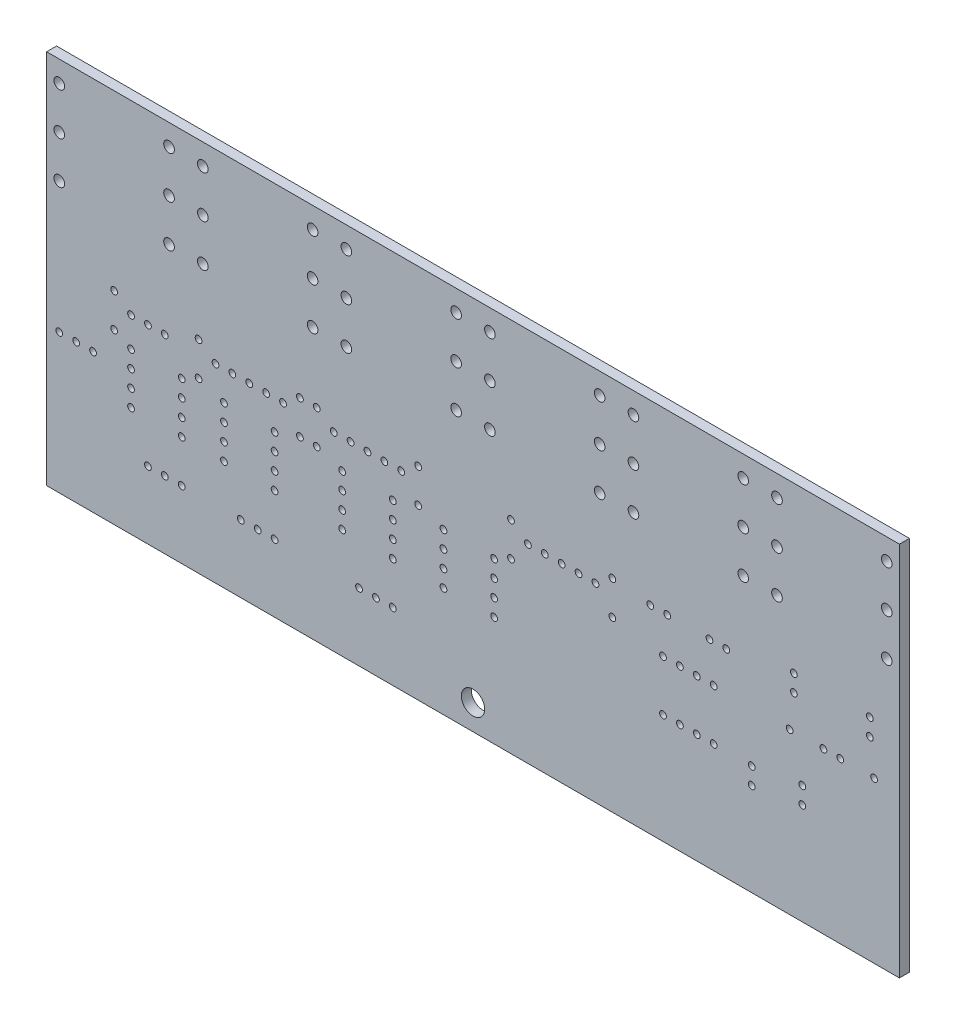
SolidWorks part; units mm, degrees
ref_plane "Front Plane" through (0, 0, 0) normal (0, 0, 1) x (1, 0, 0)
ref_plane "Top Plane" through (0, 0, 0) normal (0, 1, 0) x (1, 0, 0)
ref_plane "Right Plane" through (0, 0, 0) normal (1, 0, 0) x (0, 0, -1)
sketch "Sketch1" plane through (0, 0, 0) normal (0, 0, 1) x (1, 0, 0)
  line L1 (0, 0) -> (128.27, 0)
  line L2 (0, 0) -> (0, -56.515)
  line L3 (0, -56.515) -> (128.27, -56.515)
  line L4 (128.27, 0) -> (128.27, -56.515)
  circle A0 centre (88.265, -3.175) radius 0.8001
  circle A1 centre (82.55, -27.94) radius 0.508
  circle A2 centre (1.905, -35.56) radius 0.508
  circle A3 centre (6.985, -35.56) radius 0.508
  circle A4 centre (113.665, -41.275) radius 0.508
  circle A5 centre (12.7, -27.94) radius 0.508
  circle A6 centre (17.78, -27.94) radius 0.508
  circle A7 centre (15.24, -27.94) radius 0.508
  circle A8 centre (1.905, -3.175) radius 0.8001
  circle A9 centre (1.905, -9.525) radius 0.8001
  circle A10 centre (1.905, -15.875) radius 0.8001
  circle A11 centre (18.415, -3.175) radius 0.8001
  circle A12 centre (18.415, -15.875) radius 0.8001
  circle A13 centre (23.495, -3.175) radius 0.8001
  circle A14 centre (18.415, -9.525) radius 0.8001
  circle A15 centre (23.495, -9.525) radius 0.8001
  circle A16 centre (23.495, -15.875) radius 0.8001
  circle A17 centre (40.005, -3.175) radius 0.8001
  circle A18 centre (40.005, -9.525) radius 0.8001
  circle A19 centre (40.005, -15.875) radius 0.8001
  circle A20 centre (25.4, -27.94) radius 0.508
  circle A21 centre (15.24, -46.355) radius 0.508
  circle A22 centre (88.265, -9.525) radius 0.8001
  circle A23 centre (33.02, -27.94) radius 0.508
  circle A24 centre (88.265, -15.875) radius 0.8001
  circle A25 centre (27.94, -27.94) radius 0.508
  circle A26 centre (30.48, -27.94) radius 0.508
  circle A27 centre (104.775, -3.175) radius 0.8001
  circle A28 centre (52.07, -46.355) radius 0.508
  circle A29 centre (46.99, -46.355) radius 0.508
  circle A30 centre (104.775, -9.525) radius 0.8001
  circle A31 centre (4.445, -35.56) radius 0.508
  circle A32 centre (17.78, -46.355) radius 0.508
  circle A33 centre (104.775, -15.875) radius 0.8001
  circle A34 centre (109.855, -3.175) radius 0.8001
  circle A35 centre (20.32, -46.355) radius 0.508
  circle A36 centre (43.18, -27.94) radius 0.508
  circle A37 centre (35.56, -27.94) radius 0.508
  circle A38 centre (109.855, -9.525) radius 0.8001
  circle A39 centre (109.855, -15.875) radius 0.8001
  circle A40 centre (49.53, -46.355) radius 0.508
  circle A41 centre (126.365, -3.175) radius 0.8001
  circle A42 centre (31.75, -46.355) radius 0.508
  circle A43 centre (34.29, -46.355) radius 0.508
  circle A44 centre (29.21, -46.355) radius 0.508
  circle A45 centre (126.365, -9.525) radius 0.8001
  circle A46 centre (126.365, -15.875) radius 0.8001
  circle A47 centre (10.16, -26.035) radius 0.508
  circle A48 centre (10.16, -31.115) radius 0.508
  circle A49 centre (113.665, -38.735) radius 0.508
  circle A50 centre (22.86, -26.035) radius 0.508
  circle A51 centre (45.72, -27.94) radius 0.508
  circle A52 centre (48.26, -27.94) radius 0.508
  circle A53 centre (50.8, -27.94) radius 0.508
  circle A54 centre (53.34, -27.94) radius 0.508
  circle A55 centre (72.39, -27.94) radius 0.508
  circle A56 centre (64.135, -52.705) radius 1.7526
  circle A57 centre (74.93, -27.94) radius 0.508
  circle A58 centre (77.47, -27.94) radius 0.508
  circle A59 centre (80.01, -27.94) radius 0.508
  circle A60 centre (22.86, -31.115) radius 0.508
  circle A61 centre (38.1, -26.035) radius 0.508
  circle A62 centre (38.1, -31.115) radius 0.508
  circle A63 centre (45.085, -3.175) radius 0.8001
  circle A64 centre (45.085, -9.525) radius 0.8001
  circle A65 centre (45.085, -15.875) radius 0.8001
  circle A66 centre (61.595, -3.175) radius 0.8001
  circle A67 centre (61.595, -9.525) radius 0.8001
  circle A68 centre (61.595, -15.875) radius 0.8001
  circle A69 centre (66.675, -3.175) radius 0.8001
  circle A70 centre (66.675, -9.525) radius 0.8001
  circle A71 centre (66.675, -15.875) radius 0.8001
  circle A72 centre (83.185, -3.175) radius 0.8001
  circle A73 centre (83.185, -9.525) radius 0.8001
  circle A74 centre (83.185, -15.875) radius 0.8001
  circle A75 centre (40.64, -26.035) radius 0.508
  circle A76 centre (40.64, -31.115) radius 0.508
  circle A77 centre (55.88, -26.035) radius 0.508
  circle A78 centre (55.88, -31.115) radius 0.508
  circle A79 centre (69.85, -26.035) radius 0.508
  circle A80 centre (69.85, -31.115) radius 0.508
  circle A81 centre (85.09, -26.035) radius 0.508
  circle A82 centre (85.09, -31.115) radius 0.508
  circle A83 centre (90.805, -26.67) radius 0.508
  circle A84 centre (93.345, -26.67) radius 0.508
  circle A85 centre (99.695, -26.67) radius 0.508
  circle A86 centre (102.235, -26.67) radius 0.508
  circle A87 centre (106.045, -40.005) radius 0.508
  circle A88 centre (106.045, -42.545) radius 0.508
  circle A89 centre (112.395, -24.765) radius 0.508
  circle A90 centre (112.395, -27.305) radius 0.508
  circle A91 centre (123.825, -24.765) radius 0.508
  circle A92 centre (123.825, -27.305) radius 0.508
  circle A93 centre (111.76, -32.385) radius 0.508
  circle A94 centre (116.84, -32.385) radius 0.508
  circle A95 centre (119.38, -32.385) radius 0.508
  circle A96 centre (124.46, -32.385) radius 0.508
  circle A97 centre (92.71, -32.385) radius 0.508
  circle A98 centre (95.25, -32.385) radius 0.508
  circle A99 centre (97.79, -32.385) radius 0.508
  circle A100 centre (100.33, -32.385) radius 0.508
  circle A101 centre (92.71, -40.005) radius 0.508
  circle A102 centre (95.25, -40.005) radius 0.508
  circle A103 centre (97.79, -40.005) radius 0.508
  circle A104 centre (100.33, -40.005) radius 0.508
  circle A105 centre (67.31, -40.005) radius 0.508
  circle A106 centre (67.31, -37.465) radius 0.508
  circle A107 centre (67.31, -34.925) radius 0.508
  circle A108 centre (67.31, -32.385) radius 0.508
  circle A109 centre (59.69, -40.005) radius 0.508
  circle A110 centre (59.69, -37.465) radius 0.508
  circle A111 centre (59.69, -34.925) radius 0.508
  circle A112 centre (59.69, -32.385) radius 0.508
  circle A113 centre (34.29, -40.005) radius 0.508
  circle A114 centre (34.29, -37.465) radius 0.508
  circle A115 centre (34.29, -34.925) radius 0.508
  circle A116 centre (34.29, -32.385) radius 0.508
  circle A117 centre (26.67, -40.005) radius 0.508
  circle A118 centre (26.67, -37.465) radius 0.508
  circle A119 centre (26.67, -34.925) radius 0.508
  circle A120 centre (26.67, -32.385) radius 0.508
  circle A121 centre (52.07, -40.005) radius 0.508
  circle A122 centre (52.07, -37.465) radius 0.508
  circle A123 centre (52.07, -34.925) radius 0.508
  circle A124 centre (52.07, -32.385) radius 0.508
  circle A125 centre (44.45, -40.005) radius 0.508
  circle A126 centre (44.45, -37.465) radius 0.508
  circle A127 centre (44.45, -34.925) radius 0.508
  circle A128 centre (44.45, -32.385) radius 0.508
  circle A129 centre (20.32, -40.005) radius 0.508
  circle A130 centre (20.32, -37.465) radius 0.508
  circle A131 centre (20.32, -34.925) radius 0.508
  circle A132 centre (20.32, -32.385) radius 0.508
  circle A133 centre (12.7, -40.005) radius 0.508
  circle A134 centre (12.7, -37.465) radius 0.508
  circle A135 centre (12.7, -34.925) radius 0.508
  circle A136 centre (12.7, -32.385) radius 0.508
sheet metal parameters "Sheet-Metal1" thickness 1.4986 parameters "D1"=0.7366
base flange "Base-Flange1" sketch "Sketch1" thickness 1.4986 reverse thickness direction no parameters "D1"=0.7366
flat pattern "Flat-Pattern1"
sketch "Bend-Lines1" plane through (0, 0, 0) normal (0, 1, 0) x (-1, 0, 0)
